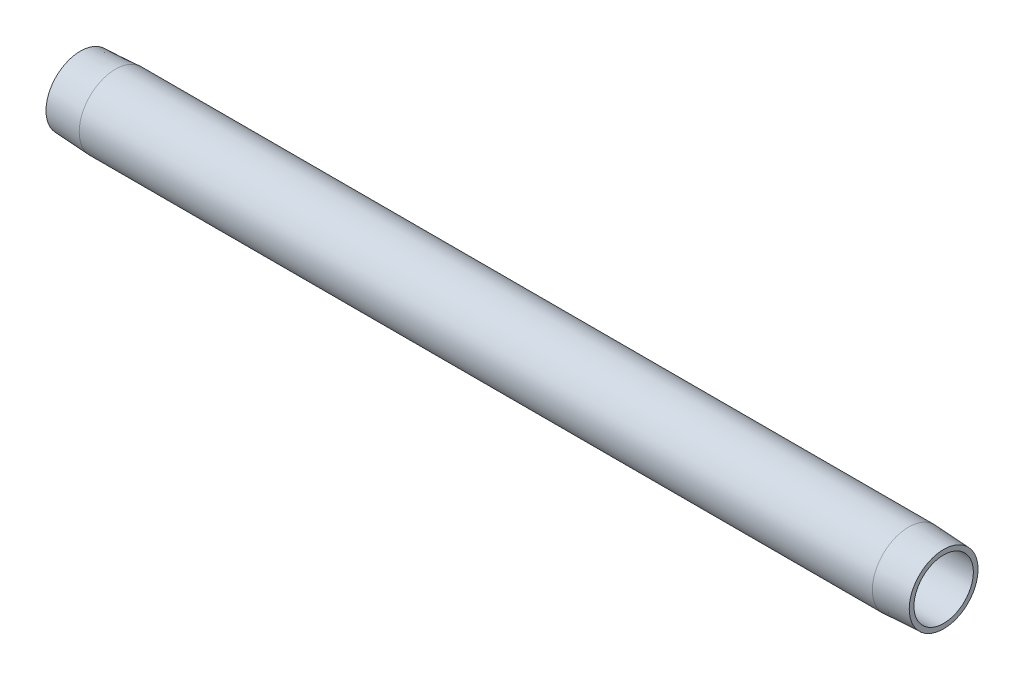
SolidWorks part; units mm, degrees
ref_plane "Front Plane" through (0, 0, 0) normal (0, 0, 1) x (1, 0, 0)
ref_plane "Top Plane" through (0, 0, 0) normal (0, 1, 0) x (1, 0, 0)
ref_plane "Right Plane" through (0, 0, 0) normal (1, 0, 0) x (0, 0, -1)
sketch "Sketch1" plane through (0, 0, 0) normal (0, 0, 1) x (1, 0, 0)
  line L6 (254, 8.7313) -> (0, 8.7313)
  line L7 (10.3124, 10.668) -> (0, 10.1276)
  line L8 (243.6876, 10.668) -> (10.3124, 10.668)
  line L9 (254, 10.1276) -> (243.6876, 10.668)
  line L10 (254, 8.7313) -> (254, 10.1276)
  line L11 (0, 10.1276) -> (0, 8.7313)
  line L12 (0, 0) -> (50000, 0) construction
  line L13 (0, -55) -> (0, 55) construction
  dimension "D1" = 254
  dimension "D2" = 3
  dimension "D3" = 3
  dimension "D4" = 21.336
  dimension "D5" = 17.4625
  dimension "D6" = 10.3124
  dimension "D7" = 10.3124
revolve "Revolve1" add sketch "Sketch1" angle 360 about L12
